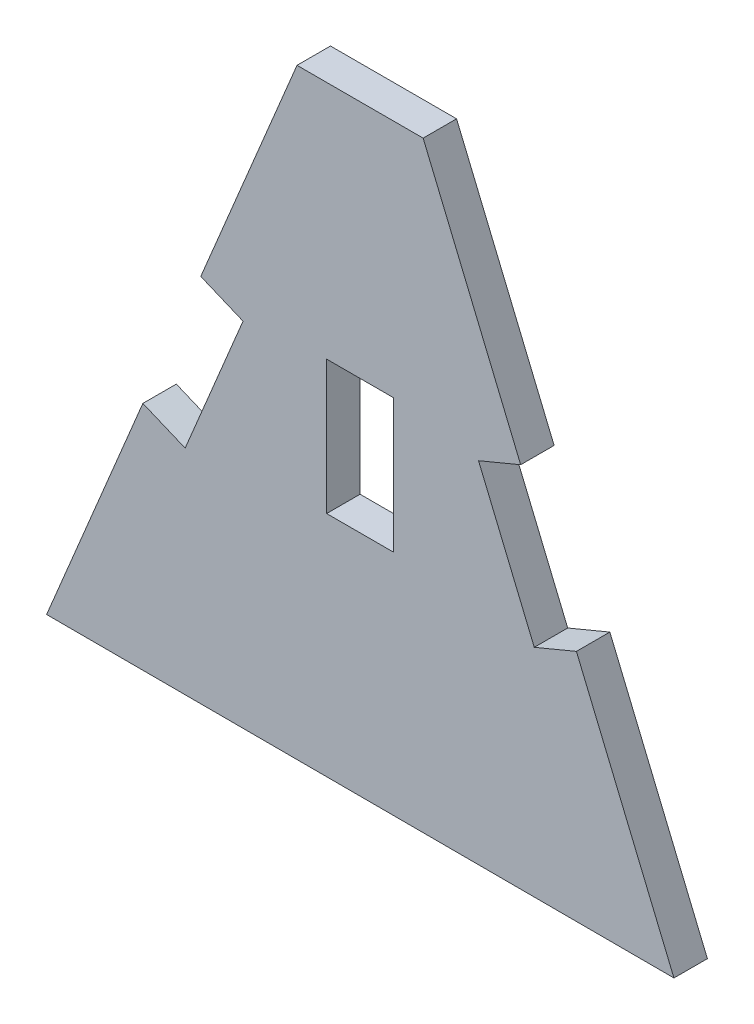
SolidWorks part; units mm, degrees
ref_plane "Front Plane" through (0, 0, 0) normal (0, 0, 1) x (1, 0, 0)
ref_plane "Top Plane" through (0, 0, 0) normal (0, 1, 0) x (1, 0, 0)
ref_plane "Right Plane" through (0, 0, 0) normal (1, 0, 0) x (0, 0, -1)
sketch "Sketch1" plane through (0, 0, 0) normal (0, 0, 1) x (1, 0, 0)
  line L0 (-14.2963, -13.6665) -> (-9.9088, -3.1394)
  line L1 (-2.883, 13.7179) -> (2.8646, 13.7179)
  line L2 (2.8646, 13.7179) -> (7.3104, 3.048)
  line L3 (14.2963, -13.7179) -> (-14.2963, -13.6665)
  line L4 (9.8505, -3.048) -> (14.2963, -13.7179)
  line L5 (7.3104, 3.048) -> (5.3898, 2.2477)
  line L6 (9.8505, -3.048) -> (7.9298, -3.8483)
  line L7 (-7.2705, 3.1908) -> (-2.883, 13.7179)
  line L8 (5.3898, 2.2477) -> (7.9298, -3.8483)
  line L9 (-9.9088, -3.1394) -> (-7.9822, -3.9424)
  line L10 (-7.2705, 3.1908) -> (-5.3439, 2.3879)
  line L11 (-7.9822, -3.9424) -> (-5.3439, 2.3879)
  line L12 (-0.0092, 13.7179) -> (-0.0092, 2.7959) construction
  line L13 (-0.0092, 2.7959) -> (-0.0092, -3.3001) construction
  line L14 (-1.5332, 2.7959) -> (-1.5332, -3.3001)
  line L15 (1.5148, 2.7959) -> (1.5148, -3.3001)
  line L16 (-1.5332, 2.7959) -> (1.5148, 2.7959)
  line L17 (-1.5332, -3.3001) -> (1.5148, -3.3001)
  dimension "D1" = 10.922
  dimension "D2" = 6.096
  dimension "D3" = 1.524
  dimension "D4" = 1.524
extrude "Boss-Extrude1" add sketch "Sketch1" along normal blind 1.524
